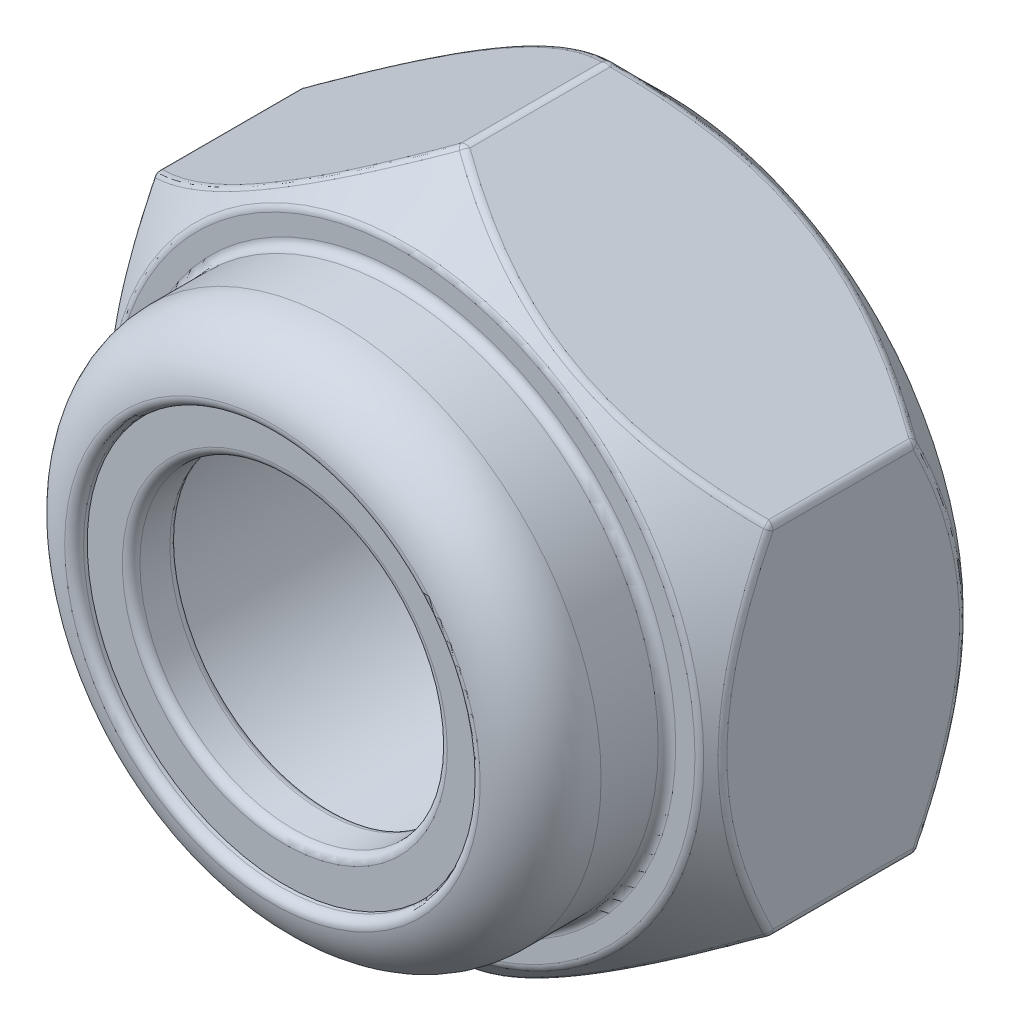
SolidWorks part; units mm, degrees
ref_plane "Face" through (0, 0, 0) normal (0, 0, 1) x (1, 0, 0)
ref_plane "Dessus" through (0, 0, 0) normal (0, 1, 0) x (1, 0, 0)
ref_plane "Droite" through (0, 0, 0) normal (1, 0, 0) x (0, 0, -1)
sketch "Esquisse1" plane through (0, 0, 0) normal (0, 0, 1) x (1, 0, 0)
  line L1 (0, 4.0415) -> (-3.5, 2.0207)
  line L2 (-3.5, 2.0207) -> (-3.5, -2.0207)
  line L3 (-3.5, -2.0207) -> (0, -4.0415)
  line L4 (0, -4.0415) -> (3.5, -2.0207)
  line L5 (3.5, -2.0207) -> (3.5, 2.0207)
  line L6 (3.5, 2.0207) -> (0, 4.0415)
  circle A0 centre (0, 0) radius 3.5 construction
  dimension "D1" = 7
extrude "Extrusion1" add sketch "Esquisse1" along normal blind 3
sketch "Esquisse2" plane through (0, 0, 3) normal (0, 0, 1) x (1, 0, 0)
  circle A0 centre (0, 0) radius 3
  dimension "D1" = 6
extrude "Extrusion2" add sketch "Esquisse2" along normal blind 1.5
sketch "Esquisse3" plane through (0, 0, 4.5) normal (0, 0, 1) x (1, 0, 0)
  circle A0 centre (0, 0) radius 2.25
  dimension "D1" = 4.5
extrude "Enlèv. mat.-Extru.1" cut sketch "Esquisse3" against normal through all
sketch "Esquisse4" plane through (0, 0, 0) normal (0, 1, 0) x (1, 0, 0)
  line L0 (0, 0) -> (0, -4.8427) construction
  line L1 (-2, -3.8096) -> (-1.75, -3.8096)
  line L2 (-2.6029, -3.8096) -> (-2.6029, -4.3505)
  line L3 (-2.6029, -4.3505) -> (-1.75, -4.3505)
  line L4 (-1.75, -3.8096) -> (-1.75, -4.3505)
  line L5 (-2, -3.8096) -> (-2, 0)
  line L6 (0, 0) -> (-3.5, 0) construction
  line L7 (-2, 0) -> (-2.6029, 0)
  line L8 (-2.6029, 0) -> (-2.6029, -3.8096)
  dimension "D1" = 2
  dimension "D2" = 1.75
revolve "Révolution1" add sketch "Esquisse4" angle 360 about L0
sketch "Esquisse5" plane through (0, 0, 0) normal (1, 0, 0) x (0, 0, -1)
  line L0 (0, 0) -> (-6.4644, 0) construction
  line L1 (0.1793, 3.1924) -> (-1.0376, 4.4093)
  line L2 (-1.0376, 4.4093) -> (0.1793, 4.4093)
  line L3 (0.1793, 4.4093) -> (0.1793, 3.1924)
  line L5 (-3.1676, 4.4093) -> (-3.1676, 3.1924)
  line L6 (-1.9507, 4.4093) -> (-3.1676, 4.4093)
  line L7 (-3.1676, 3.1924) -> (-1.9507, 4.4093)
  dimension "D1" = 45
revolve "Enlèvement de matière-Révolution1" cut sketch "Esquisse5" angle 360 about L0
fillet "Congé1" radius 0.75
fillet "Congé2" radius 0.1
fillet "Congé3" radius 0.1
fillet "Congé4" radius 0.1
